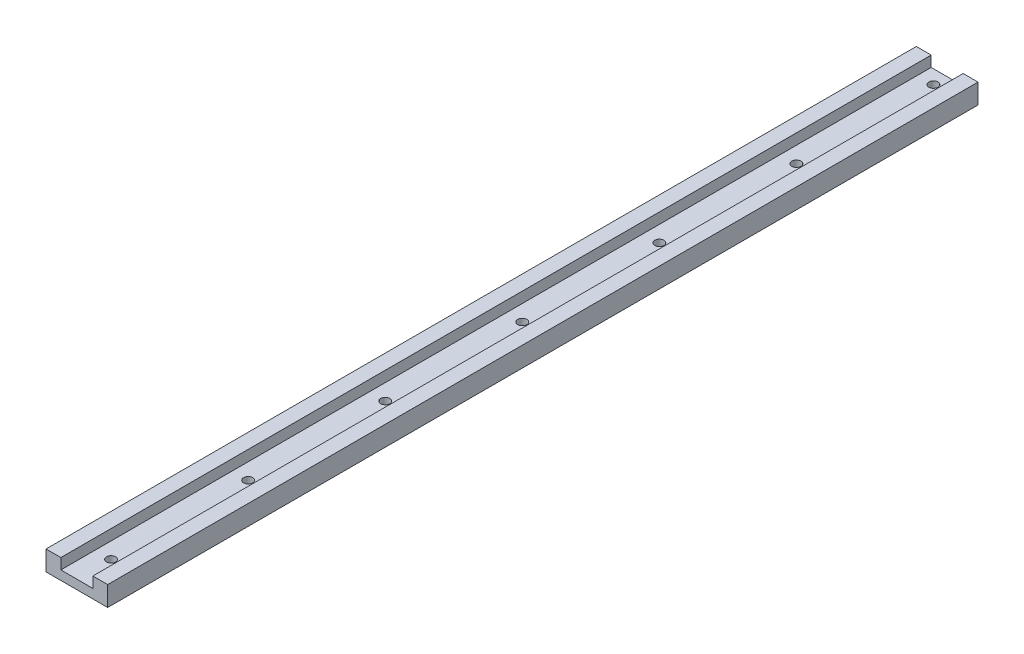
SolidWorks part; units mm, degrees
ref_plane "Front Plane" through (0, 0, 0) normal (0, 0, 1) x (1, 0, 0)
ref_plane "Top Plane" through (0, 0, 0) normal (0, 1, 0) x (1, 0, 0)
ref_plane "Right Plane" through (0, 0, 0) normal (1, 0, 0) x (0, 0, -1)
sketch "Sketch1" plane through (0, 0, 0) normal (0, 0, 1) x (1, 0, 0)
  line L0 (7, 4.35) -> (13.5, 4.35)
  line L1 (-13.5, -4.35) -> (13.5, -4.35)
  line L2 (-13.5, -4.35) -> (-13.5, 4.35)
  line L3 (-13.5, 4.35) -> (-7, 4.35)
  line L4 (13.5, -4.35) -> (13.5, 4.35)
  line L5 (-13.5, -4.35) -> (13.5, 4.35) construction
  line L6 (-13.5, 4.35) -> (13.5, -4.35) construction
  line L7 (0, -0.35) -> (0, -4.35) construction
  line L8 (-7, 4.35) -> (-7, -0.35)
  line L9 (-7, -0.35) -> (7, -0.35)
  line L10 (7, 4.35) -> (7, -0.35)
  point P0 (0, 0)
  dimension "D1" = 14
  dimension "D2" = 8.7
  dimension "D3" = 27
  dimension "D4" = 4
extrude "Boss-Extrude1" add sketch "Sketch1" along normal blind 381
sketch "Sketch2" plane through (0, -0.35, 0) normal (0, 1, 0) x (1, 0, 0)
  line L0 (0, -381) -> (0, -366) construction
  line L1 (7, -381) -> (-7, -381) construction
  circle A0 centre (0, -366) radius 2
  dimension "D1" = 4
  dimension "D2" = 15
extrude "Cut-Extrude1" cut sketch "Sketch2" against normal through all
pattern_linear "LPattern1" count 10 spacing 60 along (0, 0, -1) of "Cut-Extrude1"
